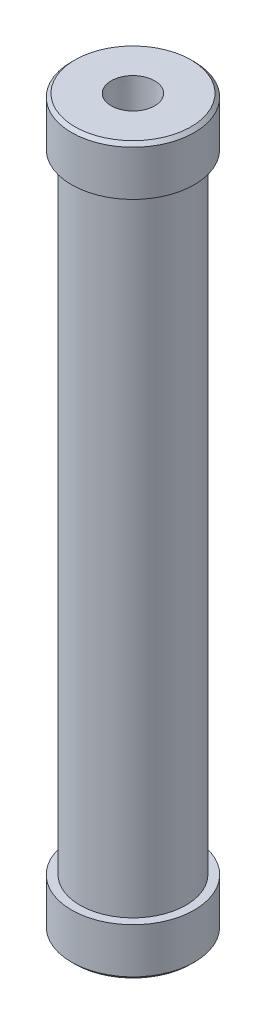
SolidWorks part; units mm, degrees
ref_plane "Front Plane" through (0, 0, 0) normal (0, 0, 1) x (1, 0, 0)
ref_plane "Top Plane" through (0, 0, 0) normal (0, 1, 0) x (1, 0, 0)
ref_plane "Right Plane" through (0, 0, 0) normal (1, 0, 0) x (0, 0, -1)
sketch "Sketch1" plane through (0, 0, 0) normal (0, 1, 0) x (1, 0, 0)
  circle A0 centre (0, 0) radius 24.13
  circle A1 centre (0, 0) radius 20.32
  dimension "D1" = 48.26
  dimension "D2" = 3.81
extrude "Boss-Extrude1" add sketch "Sketch1" along normal blind 330.2
sketch "Sketch2" plane through (0, 0, 0) normal (0, 1, 0) x (1, 0, 0)
  circle A0 centre (0, 0) radius 27.94
  dimension "D1" = 55.88
extrude "Boss-Extrude2" add sketch "Sketch2" along normal blind 22.098
ref_plane "Plane1" through (0, 330.2, 0) normal (0, 1, 0) x (1, 0, 0)
sketch "Sketch3" plane through (0, 330.2, 0) normal (0, 1, 0) x (1, 0, 0)
  circle A0 centre (0, 0) radius 27.94
  dimension "D1" = 55.88
extrude "Boss-Extrude3" add sketch "Sketch3" against normal blind 22.098
hole_wizard "1/2 Rc Tapped Hole1" positions "Sketch5" profile "Sketch4" size "1/2" standard "BSI"
sketch "Sketch5" plane through (0, 330.2, 0) normal (0, 1, 0) x (1, 0, 0)
  point P0 (0, 0)
sketch "Sketch4" plane through (0, 330.2, 0) normal (1, 0, 0) x (0, 0, 1)
  line L0 (0, 0) -> (0, 29.3875)
  line L1 (8.75, 24.13) -> (0, 29.3875)
  line L2 (-8.75, 24.13) -> (0, 29.3875) construction
  line L3 (8.75, 24.13) -> (8.75, 14.986)
  line L4 (8.75, 14.986) -> (9.4283, 14.986)
  line L5 (9.4283, 14.986) -> (9.8961, 0)
  line L6 (-9.4283, 14.986) -> (-9.8961, 0) construction
  line L7 (9.8961, 0) -> (0, 0)
  line L8 (0, -6.35) -> (0, 107.95) construction
  line L11 (-8.75, 14.986) -> (-9.4283, 14.986) construction
  dimension "Tap Drill Dia." = 17.5
  dimension "Tap Drill Depth" = 24.13
  dimension "Thread Dia." = 19.7921
  dimension "Thread Angle" = 3.576
  dimension "Thread Depth" = 14.986
  dimension "Drill Angle" = 118
hole_wizard "1/2 Rc Tapped Hole2" positions "Sketch7" profile "Sketch6" size "1/2" standard "BSI"
sketch "Sketch7" plane through (0, 0, 0) normal (0, 1, 0) x (1, 0, 0)
  point P0 (0, 0)
sketch "Sketch6" plane through (0, 0, 0) normal (1, 0, 0) x (0, 0, -1)
  line L0 (0, 0) -> (0, 29.3875)
  line L1 (8.75, 24.13) -> (0, 29.3875)
  line L2 (-8.75, 24.13) -> (0, 29.3875) construction
  line L3 (8.75, 24.13) -> (8.75, 14.986)
  line L4 (8.75, 14.986) -> (9.4283, 14.986)
  line L5 (9.4283, 14.986) -> (9.8961, 0)
  line L6 (-9.4283, 14.986) -> (-9.8961, 0) construction
  line L7 (9.8961, 0) -> (0, 0)
  line L8 (0, -6.35) -> (0, 107.95) construction
  line L11 (-8.75, 14.986) -> (-9.4283, 14.986) construction
  dimension "Tap Drill Dia." = 17.5
  dimension "Tap Drill Depth" = 24.13
  dimension "Thread Dia." = 19.7921
  dimension "Thread Angle" = 3.576
  dimension "Thread Depth" = 14.986
  dimension "Drill Angle" = 118
chamfer "Chamfer1" distance 1.524 angle 45 2 edges at (0, 0, 27.94) (0, 330.2, 27.94)
